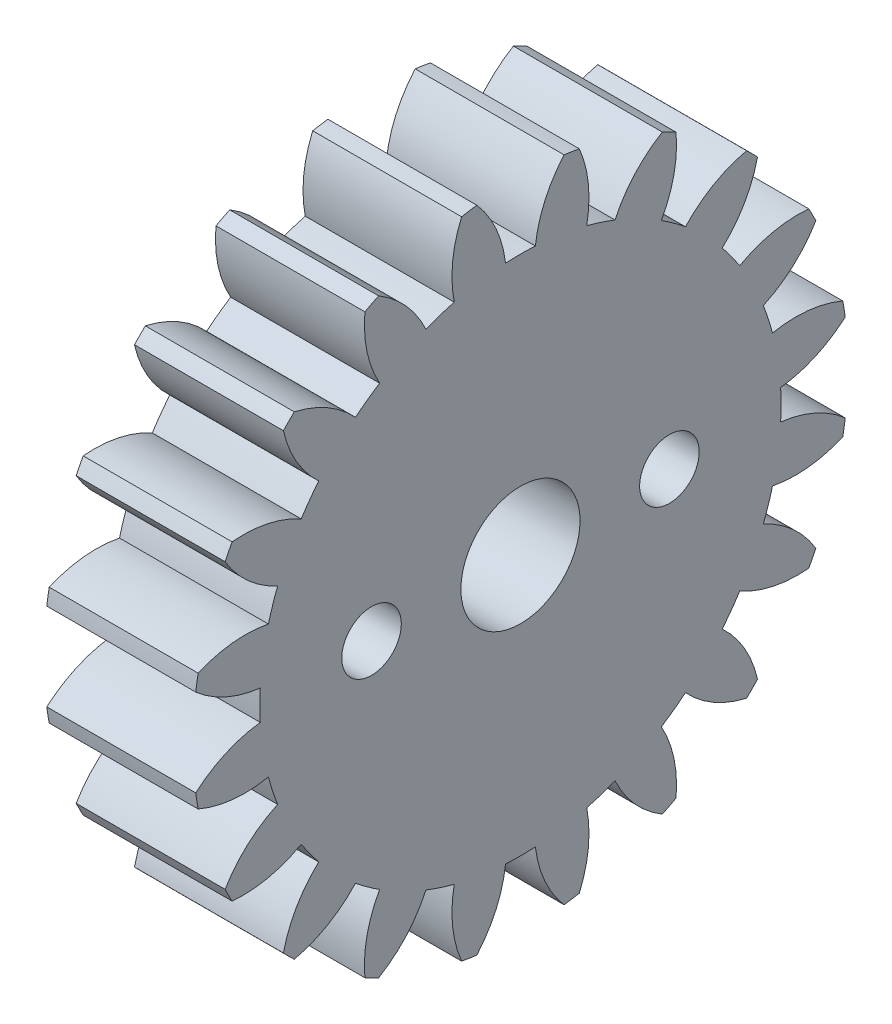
SolidWorks part; units mm, degrees
ref_plane "Front Plane" through (0, 0, 0) normal (0, 0, 1) x (1, 0, 0)
ref_plane "Top Plane" through (0, 0, 0) normal (0, 1, 0) x (1, 0, 0)
ref_plane "Right Plane" through (0, 0, 0) normal (1, 0, 0) x (0, 0, -1)
inserted part "spur gear_am<2>@tmpAssm"
sketch "Sketch1" plane through (-5.7393, 0, 0) normal (1, 0, 0) x (0, 0, -1)
  line L0 (47.0597, 26.2996) -> (55.3159, 26.2996) construction
  line L1 (47.0597, 26.2996) -> (50.7361, 32.6963) construction
  line L2 (47.0597, 26.2996) -> (38.7657, 26.2996) construction
  circle A1 centre (47.0597, 26.2996) radius 2 construction
  circle A2 centre (52.0597, 26.2996) radius 1
  circle A3 centre (42.0597, 26.2996) radius 1
  dimension "D3" = 5
  dimension "D4" = 5
  dimension "D1" = 60.113
extrude "Cut-Extrude1" cut sketch "Sketch1" against normal blind 5
sketch "Sketch2" plane through (-5.7393, 0, 0) normal (1, 0, 0) x (0, 0, -1)
  line L0 (43.0597, 26.2996) -> (51.0597, 26.2996)
  circle A0 centre (42.0597, 26.2996) radius 1 construction
  circle A1 centre (52.0597, 26.2996) radius 1 construction
